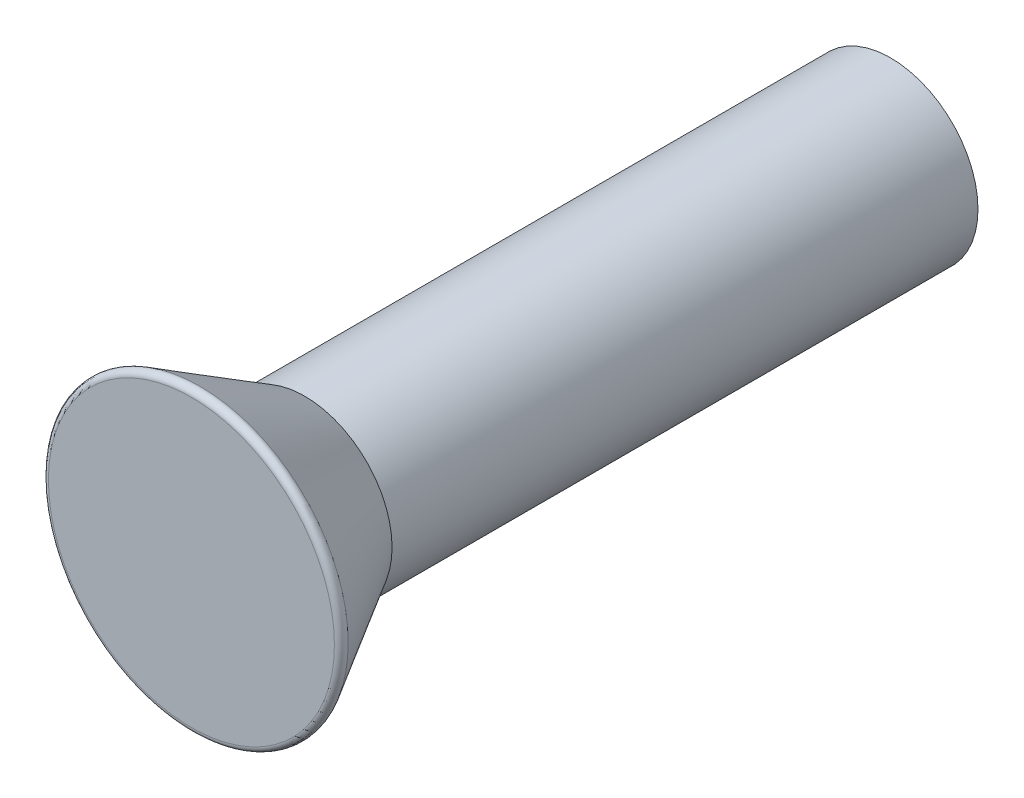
SolidWorks part; units mm, degrees
ref_plane "Front Plane" through (0, 0, 0) normal (0, 0, 1) x (1, 0, 0)
ref_plane "Top Plane" through (0, 0, 0) normal (0, 1, 0) x (1, 0, 0)
ref_plane "Right Plane" through (0, 0, 0) normal (1, 0, 0) x (0, 0, -1)
other "Configuration Table"
sketch "BaseBodySke" plane through (0, 0, 0) normal (0, 1, 0) x (1, 0, 0)
  line L0 (0, 0) -> (-5.5626, 0)
  line L1 (0, 0) -> (0, 32.7778) construction
  line L2 (0, 0) -> (0, 25.4)
  line L3 (0, 25.4) -> (-3.175, 25.4)
  line L4 (-3.175, 4.1148) -> (-3.175, 25.4)
  line L5 (-5.5626, 25.4) -> (-5.5626, 0) construction
  line L6 (-5.5626, -4.1148) -> (-5.5626, 0) construction
  line L7 (-5.5626, 0) -> (-3.175, 4.1148)
  line L9 (-3.175, 4.1148) -> (-3.175, 0) construction
revolve "BaseBody" add sketch "BaseBodySke" angle 360 about L1
fillet "Fillet" radius 0.2117 1 edges at (5.5626, 0, 0)
equation "\"D1@Fillet\" = \"Diameter@BaseBodySke\" / 30"
